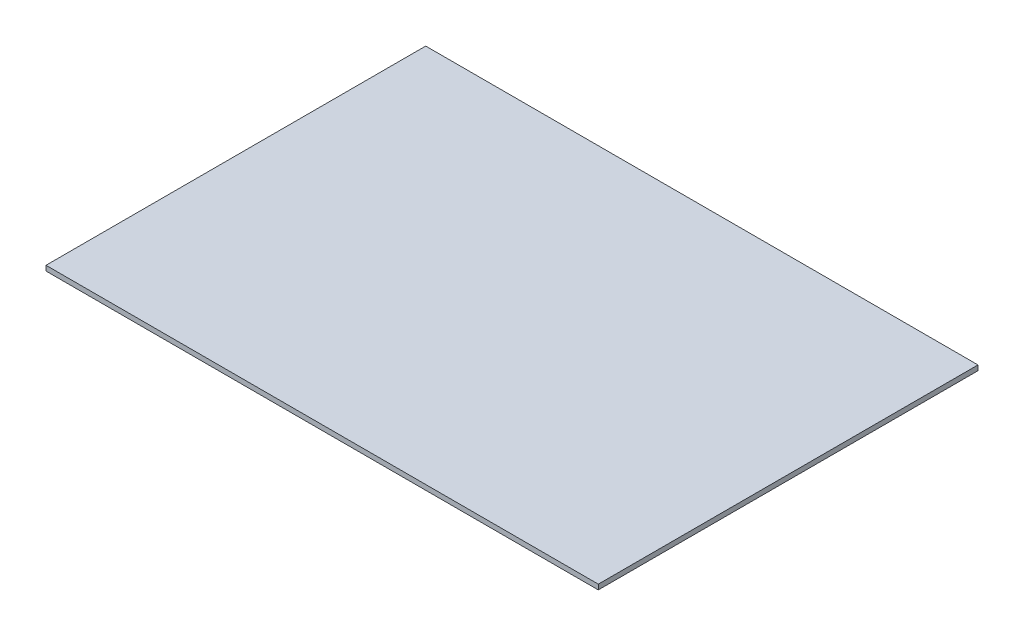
SolidWorks part; units mm, degrees
ref_plane "Front Plane" through (0, 0, 0) normal (0, 0, 1) x (1, 0, 0)
ref_plane "Top Plane" through (0, 0, 0) normal (0, 1, 0) x (1, 0, 0)
ref_plane "Right Plane" through (0, 0, 0) normal (1, 0, 0) x (0, 0, -1)
sketch "Sketch1" plane through (0, 0, 0) normal (0, 1, 0) x (1, 0, 0)
  line L1 (-304.8, -209.55) -> (304.8, -209.55)
  line L2 (-304.8, -209.55) -> (-304.8, 209.55)
  line L3 (-304.8, 209.55) -> (304.8, 209.55)
  line L4 (304.8, -209.55) -> (304.8, 209.55)
  line L5 (-304.8, -209.55) -> (304.8, 209.55) construction
  line L6 (-304.8, 209.55) -> (304.8, -209.55) construction
  point P0 (0, 0)
  dimension "D1" = 609.6
  dimension "D2" = 419.1
extrude "Boss-Extrude1" add sketch "Sketch1" along normal blind 5.5562
